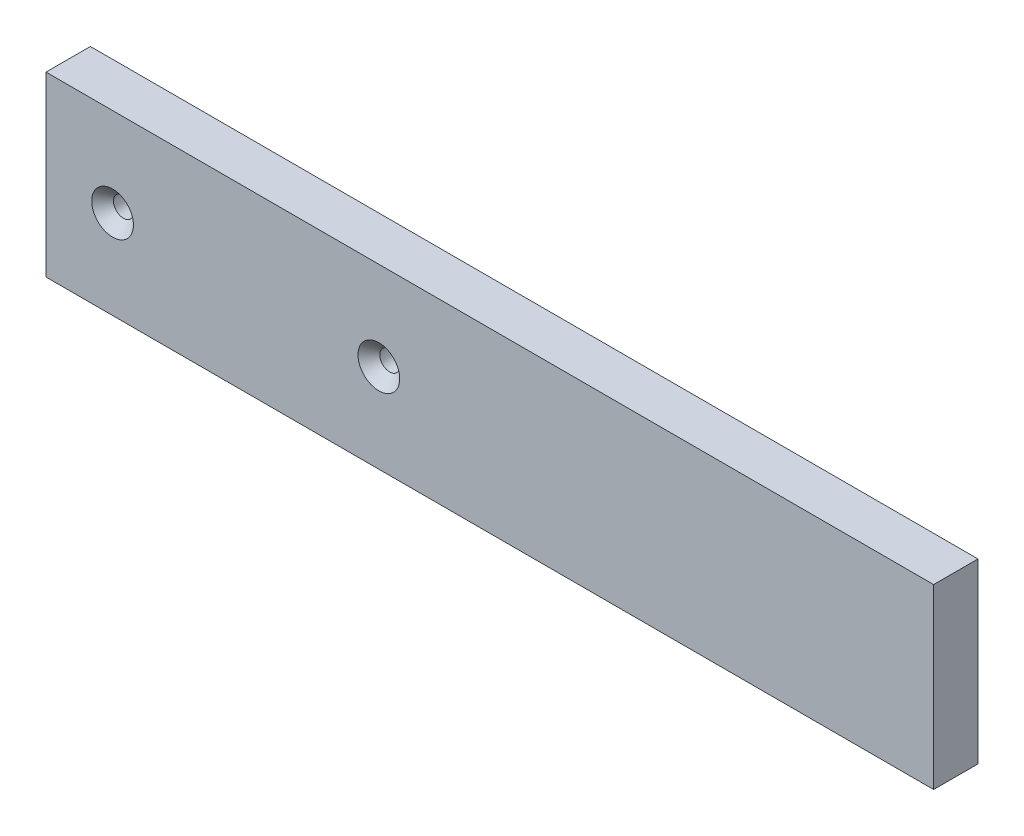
SolidWorks part; units mm, degrees
ref_plane "Front Plane" through (0, 0, 0) normal (0, 0, 1) x (1, 0, 0)
ref_plane "Top Plane" through (0, 0, 0) normal (0, 1, 0) x (1, 0, 0)
ref_plane "Right Plane" through (0, 0, 0) normal (1, 0, 0) x (0, 0, -1)
sketch "Sketch1" plane through (0, 0, 0) normal (0, 0, 1) x (1, 0, 0)
  line L1 (-100, 20) -> (100, 20)
  line L2 (-100, 20) -> (-100, -20)
  line L3 (-100, -20) -> (100, -20)
  line L4 (100, 20) -> (100, -20)
  line L5 (-100, 20) -> (100, -20) construction
  line L6 (-100, -20) -> (100, 20) construction
  point P0 (0, 0)
  dimension "D1" = 40
  dimension "D2" = 200
extrude "Boss-Extrude1" add sketch "Sketch1" along normal mid plane 10
hole_wizard "CSK for M4 Countersunk Flat Head Screw1" positions "Sketch2" profile "Sketch3" countersink size "M4" standard "DIN"
sketch "Sketch2" plane through (-37.1624, 155, 5) normal (0, 0, 1) x (0, -1, 0)
  point P0 (155, 12.1624)
  point P1 (155, -47.8376)
sketch "Sketch3" plane through (-25, 0, 5) normal (1, 0, 0) x (0, -1, 0)
  line L0 (0, 0) -> (0, 10)
  line L1 (0, 10) -> (2.25, 10)
  line L2 (2.25, 10) -> (2.25, 2.45)
  line L3 (2.25, 2.45) -> (4.7, 0)
  line L4 (4.7, 0) -> (0, 0)
  line L5 (-2.25, 2.45) -> (-4.7, 0) construction
  line L6 (0, -6.35) -> (0, 107.95) construction
  dimension "Thru Hole Dia." = 4.5
  dimension "Thru Hole Depth" = 10
  dimension "Near C'Sink Dia." = 9.4
  dimension "Near C'Sink Angle" = 90
